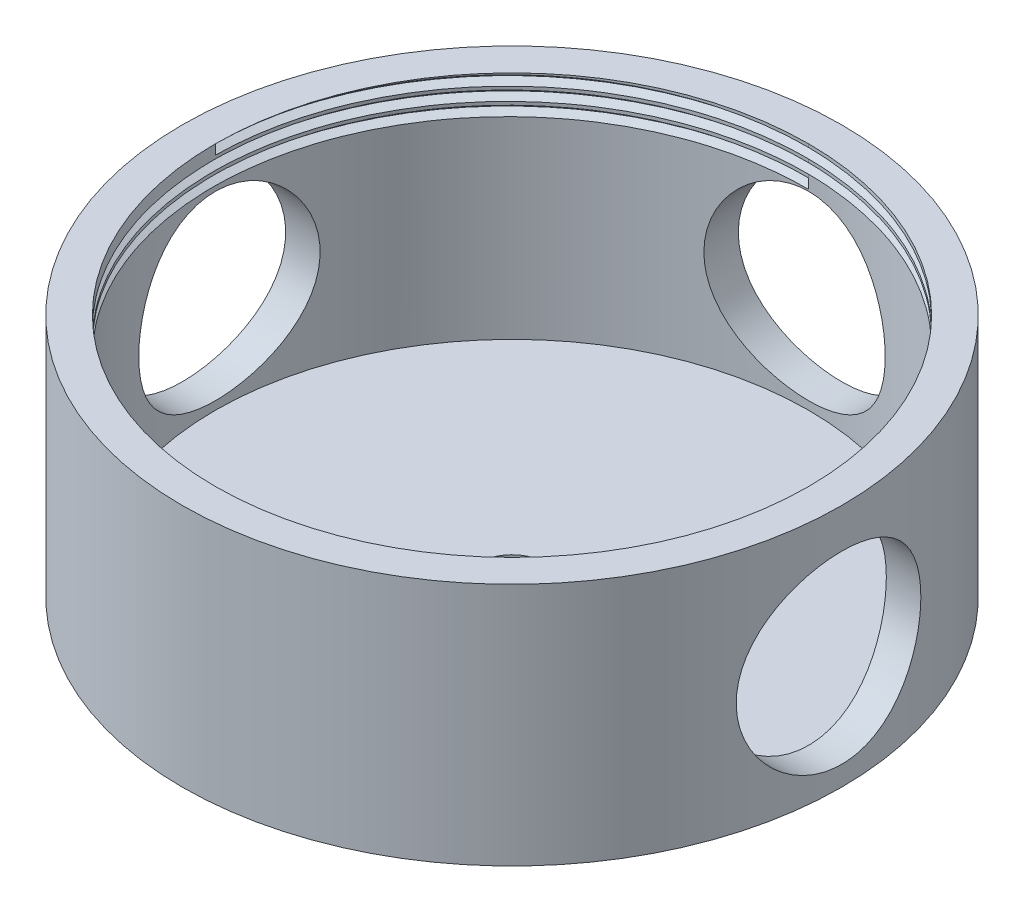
SolidWorks part; units mm, degrees
ref_plane "Front Plane" through (0, 0, 0) normal (0, 0, 1) x (1, 0, 0)
ref_plane "Top Plane" through (0, 0, 0) normal (0, 1, 0) x (1, 0, 0)
ref_plane "Right Plane" through (0, 0, 0) normal (1, 0, 0) x (0, 0, -1)
sketch "Sketch1" plane through (0, 0, 0) normal (0, 1, 0) x (1, 0, 0)
  circle A0 centre (0, 0) radius 50
  dimension "D1" = 100
extrude "Boss-Extrude1" add sketch "Sketch1" along normal blind 2 contours A0
sketch "Sketch2" plane through (0, 2, 0) normal (0, 1, 0) x (1, 0, 0)
  circle A0 centre (0, 0) radius 50
  circle A1 centre (0, 0) radius 45
  dimension "D1" = 100
  dimension "D2" = 5
extrude "Boss-Extrude2" add sketch "Sketch2" along normal blind 35
ref_plane "Plane3" through (0, 0, 40) normal (0, 0, 1) x (1, 0, 0)
sketch "Sketch5" plane through (0, 0, 40) normal (0, 0, 1) x (1, 0, 0)
  line L0 (-50, 0) -> (50, 0) construction
  line L1 (-26.6422, 0) -> (27.3578, 0)
  line L2 (-26.6422, 0) -> (-26.6422, -34)
  line L3 (-26.6422, -34) -> (27.3578, -34)
  line L4 (27.3578, 0) -> (27.3578, -34)
  line L5 (-50, 0) -> (50, 0) construction
  line L6 (-24.6422, -2) -> (25.3578, -2)
  line L7 (-24.6422, -2) -> (-24.6422, -32)
  line L8 (-24.6422, -32) -> (25.3578, -32)
  line L9 (25.3578, -2) -> (25.3578, -32)
  dimension "D1" = 2
  dimension "D2" = 2
  dimension "D3" = 2
  dimension "D4" = 2
  dimension "D5" = 50
  dimension "D6" = 2
  dimension "D7" = 30
thread "Thread1" pitch 2 start angle 0, offset 0, length 4.5, pitch 2, diameter 90
ref_plane "Plane4" through (-45, 37, 0) normal (0, 0, 1) x (-1, 0, 0)
sketch "Thread Profile1" plane through (-45, 37, 0) normal (0, 0, 1) x (-1, 0, 0)
  line L0 (0, 0) -> (0, 2) construction
  line L1 (0, 0) -> (1.0825, 0.625)
  line L2 (1.0825, 0.625) -> (1.0825, 0.875)
  line L3 (1.0825, 0.875) -> (0, 1.5)
  line L4 (1.0825, 0.75) -> (0, 0.75) construction
  line L11 (0, 0) -> (0, 1.5)
  point P2 (0, 0)
  dimension "Pitch" = 2
  dimension "Profile_Angle" = 60
  dimension "Profile_Land" = 0.25
  dimension "Profile_Height" = 1.0825
ref_plane "Plane6" through (0, 0, -50) normal (0, 0, -1) x (-1, 0, 0)
sketch "Sketch10" plane through (0, 0, -50) normal (0, 0, -1) x (-1, 0, 0)
  line L0 (0, 17) -> (-42.3594, 17) construction
  line L1 (0, 37) -> (0, 0) construction
  line L2 (50, 37) -> (-50, 37) construction
  line L3 (-42.3594, 17) -> (37.1989, 17) construction
  circle A1 centre (0, 17) radius 13.75
  dimension "D2" = 27.5
  dimension "D5" = 37
  dimension "D6" = 20
extrude "Cut-Extrude2" cut sketch "Sketch10" against normal up to next
ref_plane "Plane8" through (-50, 0, 0) normal (-1, 0, 0) x (0, 0, 1)
sketch "Sketch12" plane through (-50, 0, 0) normal (-1, 0, 0) x (0, 0, 1)
  line L1 (50, 37) -> (-50, 37) construction
  circle A0 centre (0, 17) radius 13.75
  dimension "D1" = 27.5
  dimension "D2" = 20
extrude "Cut-Extrude4" cut sketch "Sketch12" against normal up to next
ref_plane "Plane9" through (50, 0, 0) normal (1, 0, 0) x (0, 0, -1)
sketch "Sketch13" plane through (50, 0, 0) normal (1, 0, 0) x (0, 0, -1)
  line L0 (50, 37) -> (-50, 37) construction
  circle A0 centre (0, 17) radius 14
  dimension "D1" = 28
  dimension "D2" = 20
extrude "Cut-Extrude5" cut sketch "Sketch13" against normal up to next
sketch "Sketch14" plane through (0, 2, 0) normal (0, 1, 0) x (1, 0, 0)
  circle A0 centre (0, 0) radius 5
  dimension "D1" = 10
extrude "Cut-Extrude6" cut sketch "Sketch14" against normal up to next
